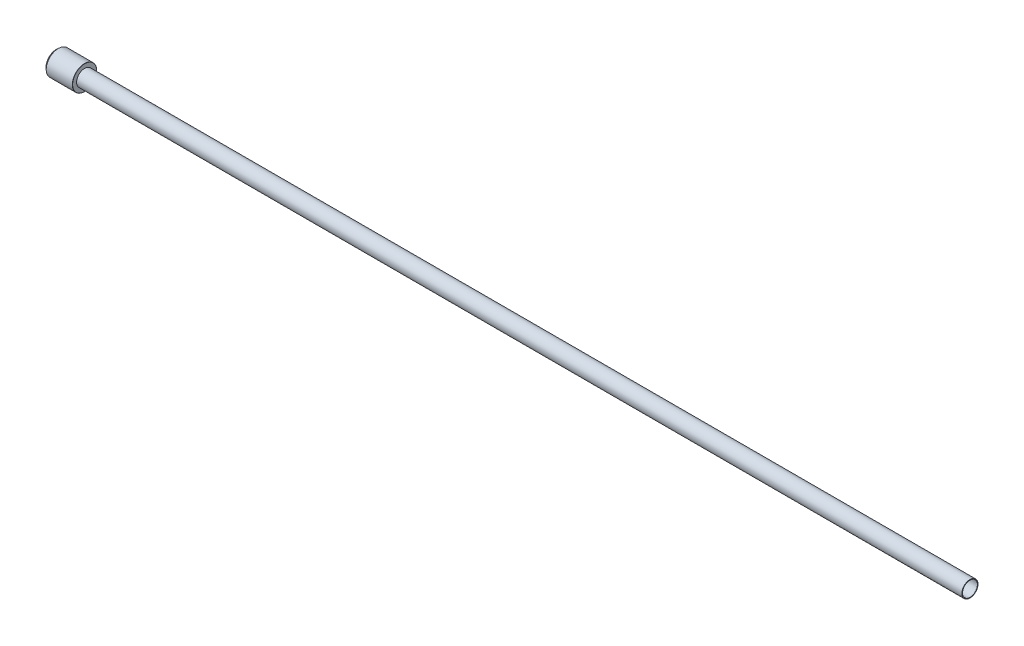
SolidWorks part; units mm, degrees
ref_plane "Front Plane" through (0, 0, 0) normal (0, 0, 1) x (1, 0, 0)
ref_plane "Top Plane" through (0, 0, 0) normal (0, 1, 0) x (1, 0, 0)
ref_plane "Right Plane" through (0, 0, 0) normal (1, 0, 0) x (0, 0, -1)
sketch "Sketch1" plane through (0, 0, 0) normal (0, 0, 1) x (1, 0, 0)
  line L0 (1.064, 6) -> (12, 6)
  line L1 (14, 3.9751) -> (450, 3.9751)
  line L2 (12, 6) -> (14, 6)
  line L4 (14, 6) -> (14, 3.9751)
  line L5 (450, 3.9751) -> (450, 3.6576)
  line L7 (450, 3.6576) -> (0, 3.6576)
  line L8 (0, 3.6576) -> (0, 5.036)
  line L9 (-22.2122, 0) -> (63.2184, 0) construction
  line L10 (0, 5.036) -> (0.1, 5.036)
  line L12 (0.1, 5.036) -> (1.064, 6)
  dimension "D2" = 12
  dimension "Thread" = 12
  dimension "D3" = 14
  dimension "tube ID" = 7.3152
  dimension "D4" = 7.9502
  dimension "D5" = 450
  dimension "minor diameter" = 10.072
  dimension "D9" = 45
  dimension "D10" = 0.1
revolve "Revolve1" add sketch "Sketch1" angle 360 about L9
fillet "Fillet2" radius 0.1 1 edges at (14, 0, 6)
